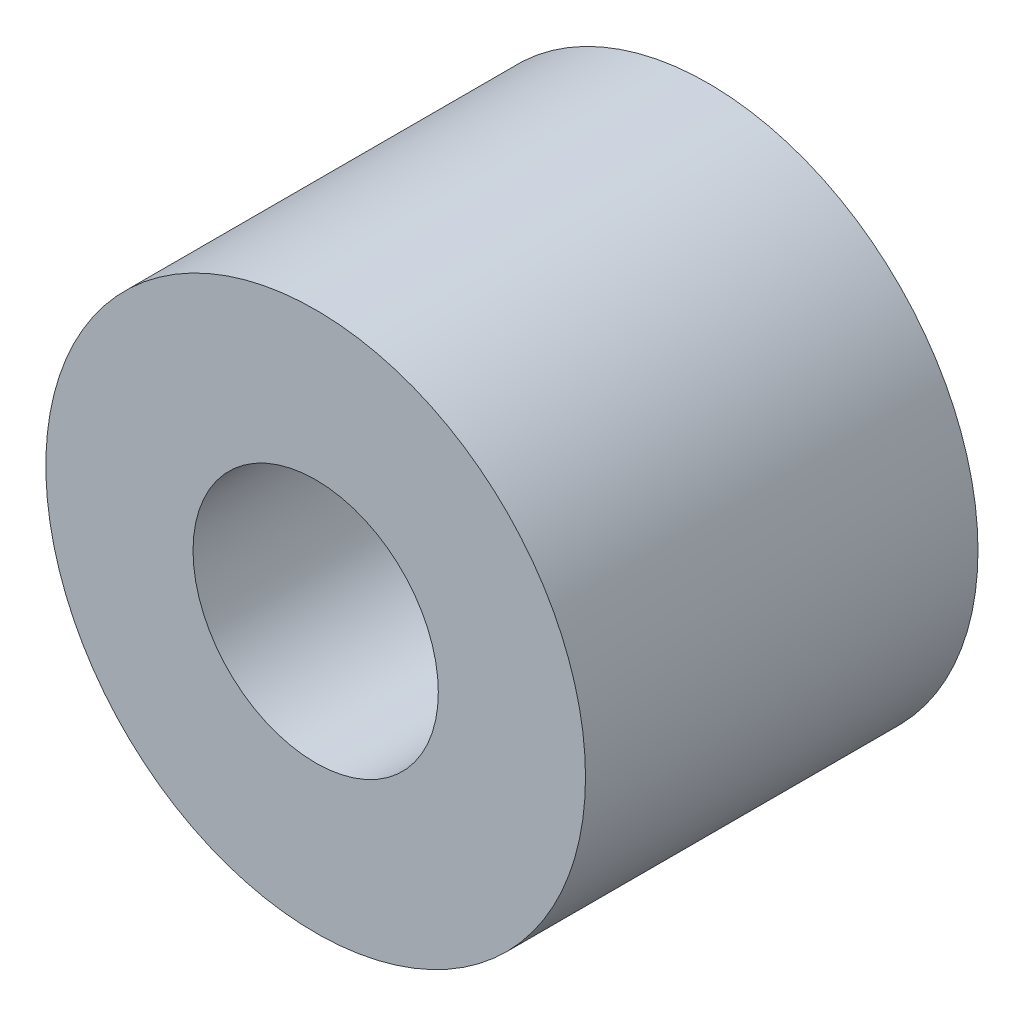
SolidWorks part; units mm, degrees
ref_plane "Face" through (0, 0, 0) normal (0, 0, 1) x (1, 0, 0)
ref_plane "Dessus" through (0, 0, 0) normal (0, 1, 0) x (1, 0, 0)
ref_plane "Droite" through (0, 0, 0) normal (1, 0, 0) x (0, 0, -1)
sketch "Esquisse1" plane through (0, 0, 0) normal (0, 0, 1) x (1, 0, 0)
  circle A0 centre (0, 0) radius 55
  circle A1 centre (0, 0) radius 25
  dimension "D1" = 110
  dimension "D2" = 50
extrude "Extrusion1" add sketch "Esquisse1" along normal blind 80
